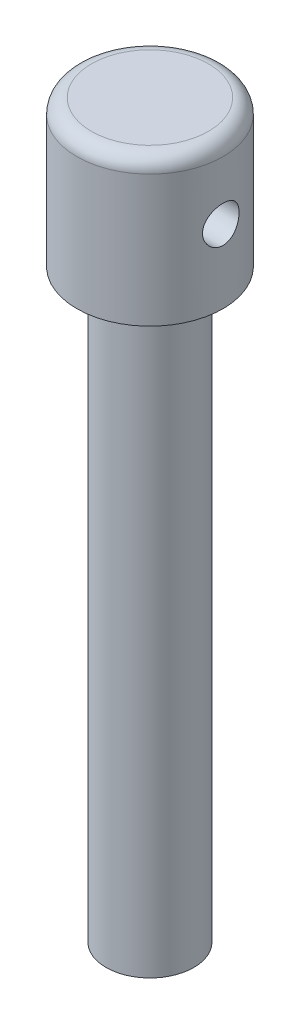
SolidWorks part; units mm, degrees
ref_plane "Front Plane" through (0, 0, 0) normal (0, 0, 1) x (1, 0, 0)
ref_plane "Top Plane" through (0, 0, 0) normal (0, 1, 0) x (1, 0, 0)
ref_plane "Right Plane" through (0, 0, 0) normal (1, 0, 0) x (0, 0, -1)
sketch "Sketch1" plane through (0, 74, 0) normal (0, 1, 0) x (1, 0, 0)
  circle A0 centre (0, 0) radius 6 construction
  circle A1 centre (0, 0) radius 6
extrude "Boss-Extrude1" add sketch "Sketch1" along normal mid plane 80
sketch "Sketch2" plane through (0, 114, 0) normal (0, 1, 0) x (1, 0, 0)
  circle A0 centre (0, 0) radius 10
  dimension "D1" = 20
extrude "Boss-Extrude2" add sketch "Sketch2" along normal blind 20
sketch "Sketch3" plane through (0, 0, 0) normal (1, 0, 0) x (0, 0, -1)
  line L0 (10, 134) -> (-10, 134) construction
  circle A0 centre (0, 124) radius 2.5
  dimension "D1" = 5
  dimension "D2" = 10
extrude "Cut-Extrude1" cut sketch "Sketch3" against normal through all both and the other way through all
fillet "Fillet1" radius 2 1 edges at (0, 134, 10)
